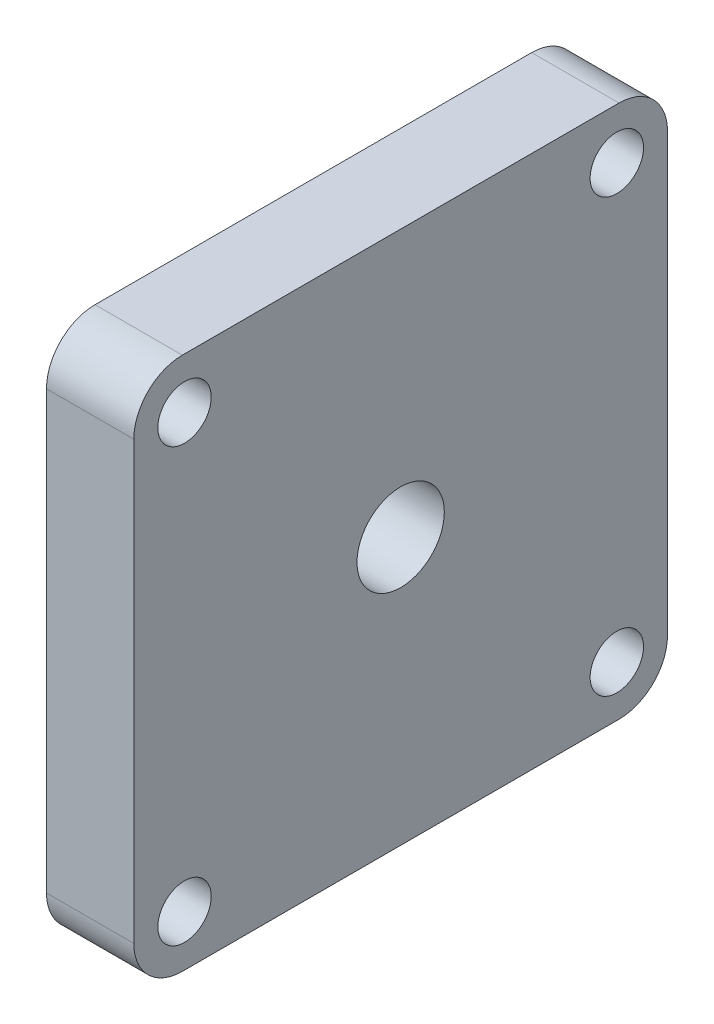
SolidWorks part; units mm, degrees
ref_plane "Plan de face" through (0, 0, 0) normal (0, 0, 1) x (1, 0, 0)
ref_plane "Plan de dessus" through (0, 0, 0) normal (0, 1, 0) x (1, 0, 0)
ref_plane "Plan de droite" through (0, 0, 0) normal (1, 0, 0) x (0, 0, -1)
ref_plane "Plan4" through (0, 0, 0) normal (1, 0, 0) x (0, 0, -1)
sketch "Esquisse1" plane through (0, 0, 0) normal (1, 0, 0) x (0, 0, -1)
  line L0 (-22.5, -27.5) -> (22.5, -27.5)
  line L1 (27.5, -22.5) -> (27.5, 22.5)
  line L2 (22.5, 27.5) -> (-22.5, 27.5)
  line L3 (-27.5, 22.5) -> (-27.5, -22.5)
  arc A0 (-27.5, -22.5) -> (-22.5, -27.5) centre (-22.5, -22.5) ccw
  arc A1 (22.5, -27.5) -> (27.5, -22.5) centre (22.5, -22.5) ccw
  arc A2 (27.5, 22.5) -> (22.5, 27.5) centre (22.5, 22.5) ccw
  arc A3 (-22.5, 27.5) -> (-27.5, 22.5) centre (-22.5, 22.5) ccw
  circle A4 centre (22.2739, -22.2739) radius 2.75
  circle A5 centre (22.2739, 22.2739) radius 2.75
  circle A6 centre (-22.2739, -22.2739) radius 2.75
  circle A7 centre (-22.2739, 22.2739) radius 2.75
extrude "Extrusion1" add sketch "Esquisse1" along normal blind 9
ref_plane "Plan5" through (0, 0, 0) normal (1, 0, 0) x (0, 0, -1)
sketch "Esquisse2" plane through (0, 0, 0) normal (1, 0, 0) x (0, 0, -1)
  circle A0 centre (0, 0) radius 20
  circle A1 centre (0, 0) radius 17.5
extrude "Extrusion2" add sketch "Esquisse2" against normal blind 2 and the other way blind 2
sketch "Esquisse3" plane through (0, 0, 0) normal (-1, 0, 0) x (0, 0, 1)
  circle A0 centre (0, 0) radius 4.5
extrude "Enlèv. mat.-Extru.1" cut sketch "Esquisse3" against normal up to next
